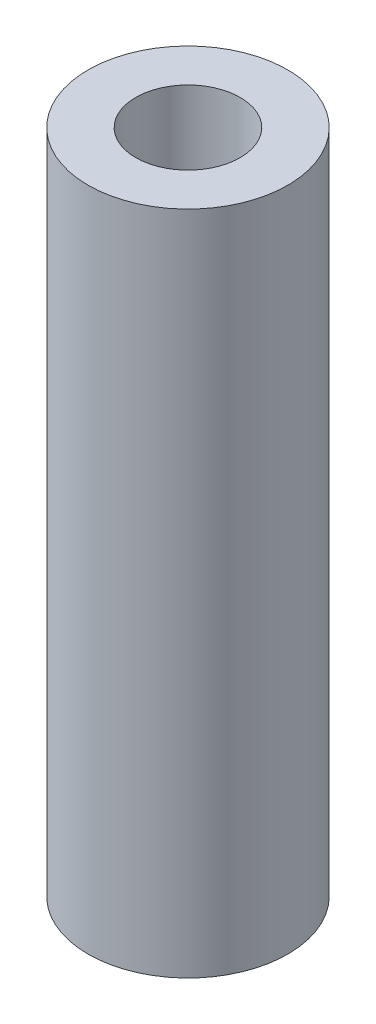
SolidWorks part; units mm, degrees
ref_plane "Front" through (0, 0, 0) normal (0, 0, 1) x (1, 0, 0)
ref_plane "Top" through (0, 0, 0) normal (0, 1, 0) x (1, 0, 0)
ref_plane "Right" through (0, 0, 0) normal (1, 0, 0) x (0, 0, -1)
sketch "Sketch1" plane through (0, 0, 0) normal (0, 1, 0) x (1, 0, 0)
  circle A0 centre (0, 0) radius 2.4892
  circle A1 centre (0, 0) radius 4.7625
  dimension "D1" = 4.9784
  dimension "D2" = 9.525
extrude "Boss-Extrude1" add sketch "Sketch1" along normal blind 31.75
